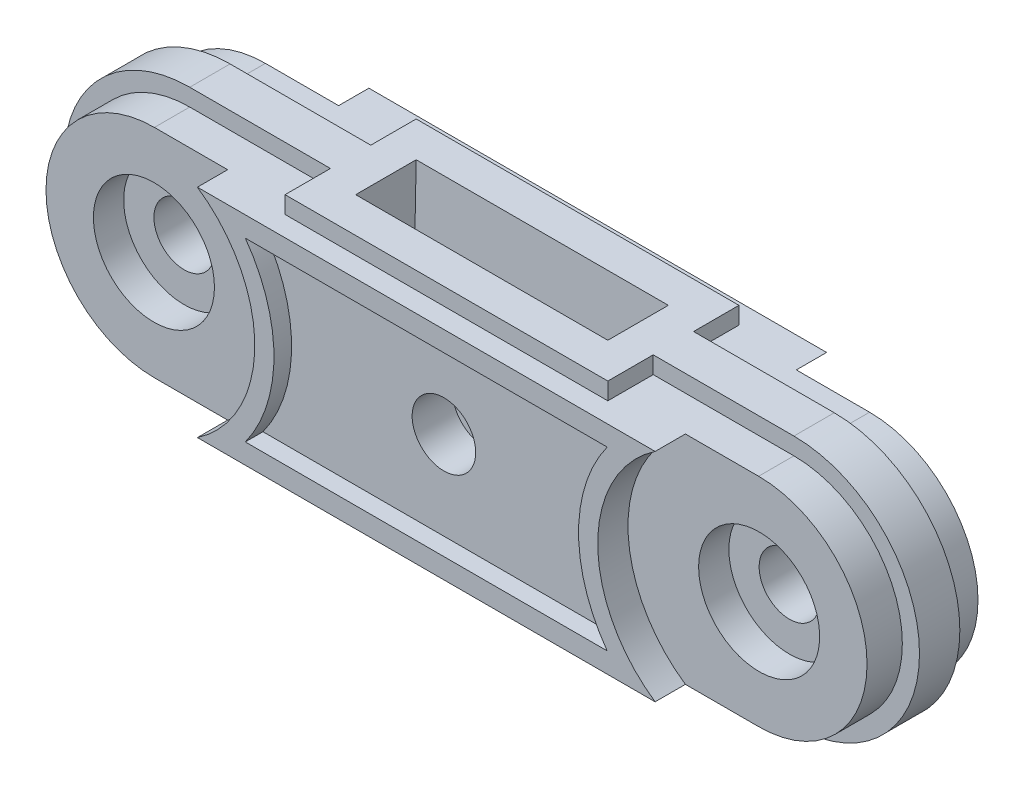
SolidWorks part; units mm, degrees
ref_plane "Front" through (0, 0, 0) normal (0, 0, 1) x (1, 0, 0)
ref_plane "Top" through (0, 0, 0) normal (0, 1, 0) x (1, 0, 0)
ref_plane "Right" through (0, 0, 0) normal (1, 0, 0) x (0, 0, -1)
sketch "Sketch1" plane through (0, 0, 0) normal (0, 1, 0) x (1, 0, 0)
  line L0 (0, 0) -> (0, 46.3538) construction
  line L1 (-82.5389, 0) -> (83.5954, 0) construction
  line L2 (0, 0) -> (40.7, 0)
  line L3 (40.7, 0) -> (40.7, -17)
  line L4 (40.7, -17) -> (0, -17)
  line L5 (0, 0) -> (-40.7, 0)
  line L6 (-40.7, 0) -> (-40.7, -17)
  line L7 (-40.7, -17) -> (0, -17)
  dimension "D1" = 81.4
  dimension "D3" = 17
extrude "Extrude1" add sketch "Sketch1" along normal blind 21.5
sketch "Sketch16" plane through (0, 0, 0) normal (0, 0, -1) x (-1, 0, 0)
  line L0 (0, 0) -> (0, 21.5) construction
  line L1 (-40.7, 21.5) -> (40.7, 21.5) construction
  line L2 (-40.7, 21.5) -> (-40.7, 0) construction
  circle A0 centre (-30, 10.75) radius 3
  circle A1 centre (30, 10.75) radius 3
  point P9 (-40.7, 10.75)
  dimension "D1" = 6
  dimension "D2" = 60
extrude "Extrude12" cut sketch "Sketch16" against normal through all
sketch "Sketch17" plane through (0, 0, 0) normal (0, 0, -1) x (-1, 0, 0)
  line L0 (40.7, 21.5) -> (40.7, 0) construction
  line L2 (-40.7, 21.5) -> (-40.7, 0) construction
  line L4 (40.7, 21.5) -> (40.7, 0)
  line L5 (-29.95, 21.5) -> (29.95, 21.5)
  line L6 (-40.7, 21.5) -> (-40.7, 0)
  line L7 (-40.7, 21.5) -> (40.7, 21.5) construction
  line L8 (0, 0) -> (0, 21.5) construction
  line L9 (-40.7, 0) -> (40.7, 0) construction
  line L10 (29.95, 0) -> (-29.95, 0)
  line L11 (-40.7, 21.5) -> (40.7, 21.5)
  line L12 (-40.7, 0) -> (40.7, 0)
  arc A0 (29.95, 21.5) -> (29.95, 0) centre (29.95, 10.75) cw
  arc A1 (-29.95, 21.5) -> (-29.95, 0) centre (-29.95, 10.75) ccw
extrude "Extrude18" cut sketch "Sketch17" against normal through all
sketch "Sketch18" plane through (0, 0, 17) normal (0, 0, 1) x (1, 0, 0)
  line L0 (-17.9398, 19.5) -> (17.9398, 19.5)
  line L1 (17.9398, 2) -> (-17.9398, 2)
  line L2 (-29.95, 21.5) -> (29.95, 21.5) construction
  line L3 (-29.95, 0) -> (29.95, 0) construction
  line L4 (0, 0) -> (0, 21.5) construction
  arc A0 (17.9398, 19.5) -> (17.9398, 2) centre (30, 10.75) ccw
  arc A1 (-17.9398, 19.5) -> (-17.9398, 2) centre (-30, 10.75) cw
  circle A2 centre (30, 10.75) radius 3 construction
  dimension "D3" = 14.9
  dimension "D1" = 2
  dimension "D2" = 2
extrude "Extrude19" cut sketch "Sketch18" against normal blind 1.75
ref_plane "Plane1" through (0, 0, 8.5) normal (0, 0, 1) x (1, 0, 0)
sketch "Sketch19" plane through (0, 0, 8.5) normal (0, 0, 1) x (1, 0, 0)
  line L0 (-29.95, 0) -> (29.95, 0) construction
  line L1 (-29.95, 21.5) -> (29.95, 21.5) construction
  line L2 (-29.95, 0) -> (29.95, 0)
  line L3 (-29.95, 21.5) -> (29.95, 21.5)
  line L6 (-29.95, 23.2) -> (29.95, 23.2)
  line L7 (-29.95, -1.7) -> (29.95, -1.7)
  arc A2 (29.95, 0) -> (29.95, 21.5) centre (29.95, 10.75) ccw construction
  arc A3 (29.95, 0) -> (29.95, 21.5) centre (29.95, 10.75) ccw
  arc A4 (-29.95, 21.5) -> (-29.95, 0) centre (-29.95, 10.75) ccw construction
  arc A5 (-29.95, 21.5) -> (-29.95, 0) centre (-29.95, 10.75) ccw
  arc A10 (29.95, -1.7) -> (29.95, 23.2) centre (29.95, 10.75) ccw
  arc A11 (-29.95, 23.2) -> (-29.95, -1.7) centre (-29.95, 10.75) ccw
  dimension "D2" = 1.7
extrude "Extrude20" add sketch "Sketch19" along normal mid plane 4
mirror "Mirror1" about plane through (0, 0, 8.5) normal (0, 0, 1) of "Extrude19"
sketch "Sketch20" plane through (0, 21.5, 0) normal (0, 1, 0) x (1, 0, 0)
  line L0 (-16, -6.5) -> (-16, -2)
  line L2 (-16, -2) -> (16, -2)
  line L3 (16, -2) -> (16, -6.5)
  line L4 (29.95, -6.5) -> (-29.95, -6.5) construction
  line L5 (29.95, 0) -> (-29.95, 0) construction
  line L6 (16, -6.5) -> (-16, -6.5)
  line L7 (29.95, -6.5) -> (-29.95, -6.5) construction
  point P4 (0, -2)
  dimension "D1" = 32
  dimension "D2" = 2
extrude "Extrude21" add sketch "Sketch20" along normal blind 1.7
mirror "Mirror2" about plane through (0, 0, 8.5) normal (0, 0, 1) of "Extrude21"
ref_plane "Plane2" through (0, 10.75, 0) normal (0, 1, 0) x (-1, 0, 0)
mirror "Mirror4" about plane through (0, 10.75, 0) normal (0, 1, 0) of "Mirror2", "Extrude21"
sketch "Sketch22" plane through (0, 0, 0) normal (1, 0, 0) x (0, 0, -1)
  line L0 (-6.5, 23.2) -> (-2, 23.2) construction
  line L2 (-10.5, 23.2) -> (-15, 23.2) construction
  line L3 (-6.5, 23.2) -> (-5.5, 23.2)
  line L4 (-10.5, 23.2) -> (-6.5, 23.2) construction
  line L5 (-10.5, 23.2) -> (-11.5, 23.2)
  line L6 (-10.5, -1.7) -> (-15, -1.7) construction
  line L8 (-6.5, -1.7) -> (-2, -1.7) construction
  line L9 (-10.5, -1.7) -> (-11, -1.7)
  line L10 (-10.5, -1.7) -> (-6.5, -1.7) construction
  line L11 (-6.5, -1.7) -> (-6, -1.7)
  line L12 (-8.5, 23.2) -> (-8.5, -1.7) construction
  line L13 (-5.5, 23.2) -> (-6, -1.7)
  line L14 (-11.5, 23.2) -> (-11, -1.7)
  line L15 (-10.5, 23.2) -> (-6.5, 23.2)
  line L16 (-10.5, -1.7) -> (-6.5, -1.7)
  dimension "D1" = 3
  dimension "D2" = 2.5
extrude "Extrude22" cut sketch "Sketch22" against normal mid plane 25
sketch "Sketch23" plane through (0, 0, 1.75) normal (0, 0, -1) x (-1, 0, 0)
  line L0 (-30, 10.75) -> (30, 10.75) construction
  circle A0 centre (0, 10.75) radius 3.15
  dimension "D1" = 6.3
extrude "Extrude23" cut sketch "Sketch23" against normal through all
sketch "Sketch24" plane through (0, 0, 17) normal (0, 0, 1) x (1, 0, 0)
  line L0 (0, 0) -> (0, 21.5) construction
  line L1 (16, 21.5) -> (-16, 21.5) construction
  circle A0 centre (-30, 10.75) radius 13
  circle A1 centre (30, 10.75) radius 13
  dimension "D1" = 26
extrude "Extrude24" cut sketch "Sketch24" against normal blind 3
mirror "Mirror5" about plane through (0, 0, 8.5) normal (0, 0, 1) of "Extrude24"
sketch "Sketch25" plane through (0, 0, 14) normal (0, 0, 1) x (1, 0, 0)
  line L0 (0, 0) -> (0, 21.5) construction
  line L1 (16, 21.5) -> (-16, 21.5) construction
  circle A0 centre (-30, 10.75) radius 6
  circle A1 centre (30, 10.75) radius 6
  dimension "D1" = 12
extrude "Extrude25" cut sketch "Sketch25" against normal blind 3
mirror "Mirror6" about plane through (0, 0, 8.5) normal (0, 0, 1) of "Extrude25"
